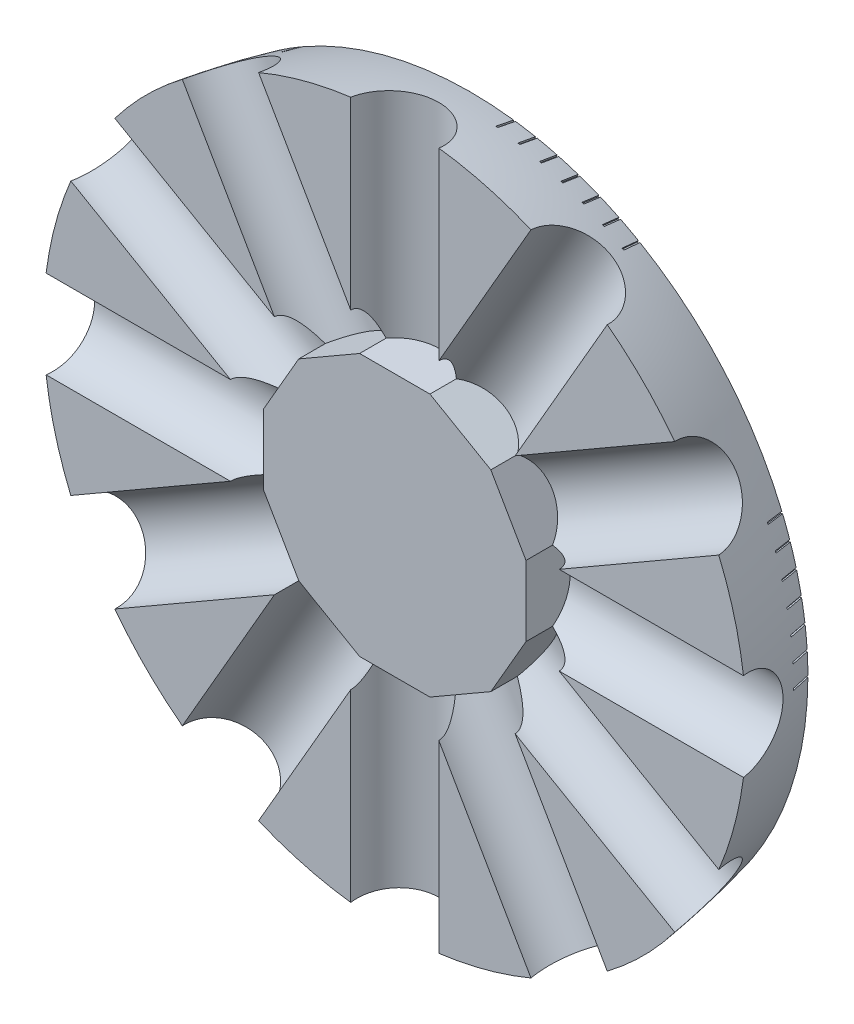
SolidWorks part; units mm, degrees
ref_plane "Front Plane" through (0, 0, 0) normal (0, 0, 1) x (1, 0, 0)
ref_plane "Top Plane" through (0, 0, 0) normal (0, 1, 0) x (1, 0, 0)
ref_plane "Right Plane" through (0, 0, 0) normal (1, 0, 0) x (0, 0, -1)
body saved out of another part "ECOSTEM-3D BLADE-HUB BASE PART"
sketch "Sketch1" plane through (0, 0, 0) normal (0, 1, 0) x (1, 0, 0)
  line L0 (22.733, 19.9136) -> (23.0135, 18.675)
  line L1 (22.86, 19.9136) -> (-22.86, 19.9136) construction
  line L2 (23.0135, 18.675) -> (23.1405, 18.675)
  line L4 (22.86, 19.9136) -> (22.733, 19.9136)
  spline S0 degree 3 poles (23.3214, 17.7673) (23.1851, 18.4871) (23.0335, 19.203) (22.86, 19.9136) knots 0.321679 0.321679 0.321679 0.321679 0.361318 0.361318 0.361318 0.361318 construction
  spline S1 degree 3 poles (23.3214, 17.7673) (23.1851, 18.4871) (23.0335, 19.203) (22.86, 19.9136) knots 0.321679 0.321679 0.321679 0.321679 0.361318 0.361318 0.361318 0.361318 construction
  spline S2 degree 3 poles (-2011.455, 212.1378) (1935.8027, -393.5072) (-1983.4395, 429.1041) (1961.4386, -218.0218) knots -69.379132 -69.379132 -69.379132 -69.379132 64.65318 64.65318 64.65318 64.65318 only from (-23.3214, 17.7673) to (-22.86, 19.9136)
  spline S3 degree 3 poles (-1961.4143, -218.0179) (1983.4081, 429.0983) (-1935.7643, -393.4996) (2011.4092, 212.1307) knots -63.652905 -63.652905 -63.652905 -63.652905 70.378613 70.378613 70.378613 70.378613 only from (22.86, 19.9136) to (23.3214, 17.7673)
  spline S4 degree 3 poles (22.86, 19.9136) (22.9604, 19.5024) (23.0535, 19.0894) (23.1405, 18.675) knots 0 0 0 0 0.578662 0.578662 0.578662 0.578662
  spline S5 degree 3 poles (-23.3214, 17.7673) (-23.1851, 18.4871) (-23.0335, 19.203) (-22.86, 19.9136) knots 0 0 0 0 1 1 1 1
  dimension "D1" = 0.127
extrude "Cut-Extrude4" cut sketch "Sketch1" against normal mid plane 0.127 contours S4 L4 L0 L2
pattern_circular "CirPattern1" count 7 every 3.75 about axis through (0, 0, 0) along (0, 0, 1) of "Cut-Extrude4"
pattern_circular "CirPattern2" count 6 over 360 about axis through (0, 0, 0) along (0, 0, 1) of "CirPattern1", "Cut-Extrude4"
